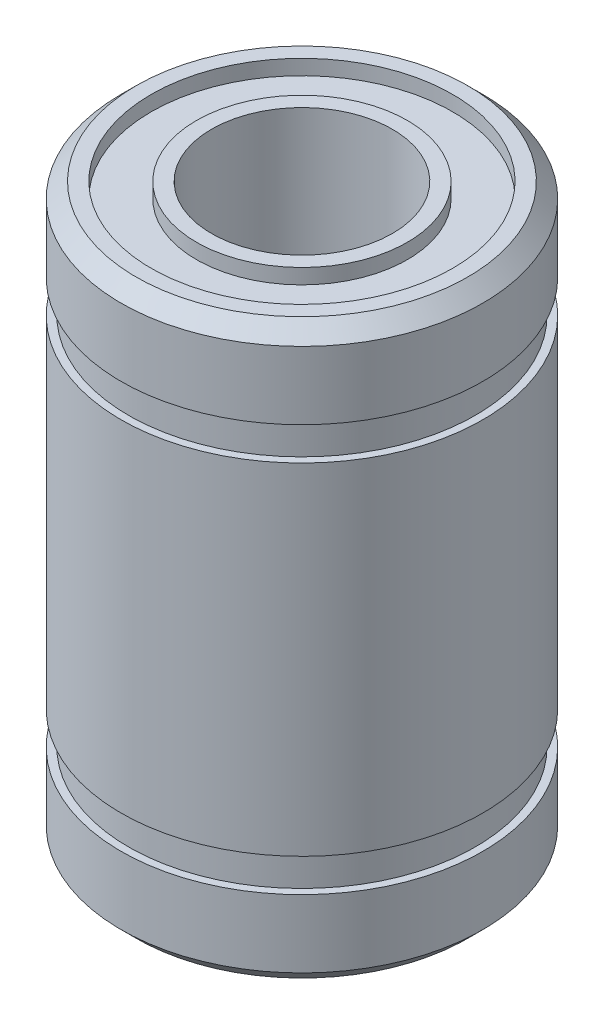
SolidWorks part; units mm, degrees
ref_plane "Front Plane" through (0, 0, 0) normal (0, 0, 1) x (1, 0, 0)
ref_plane "Top Plane" through (0, 0, 0) normal (0, 1, 0) x (1, 0, 0)
ref_plane "Right Plane" through (0, 0, 0) normal (1, 0, 0) x (0, 0, -1)
sketch "Sketch1" plane through (0, 0, 0) normal (0, 0, 1) x (1, 0, 0)
  line L0 (0, 9.5) -> (0, 0) construction
  line L1 (0, 0) -> (0, -9.5) construction
  line L2 (0, 9.5) -> (3, 9.5) construction
  line L3 (0, -9.5) -> (3, -9.5) construction
  line L4 (3, -9.5) -> (3, 9.5)
  line L5 (3, 9.5) -> (5.5, 9.5)
  line L6 (5.5, 9.5) -> (6, 9)
  line L7 (6, 9) -> (6, 6.75)
  line L8 (6, 5.65) -> (6, 6.75) construction
  line L9 (6, -6.75) -> (6, -5.65) construction
  line L10 (6, 5.65) -> (6, -5.65)
  line L11 (6, -9) -> (5.5, -9) construction
  line L12 (5.5, -9) -> (5.5, -9.5) construction
  line L13 (6, -6.75) -> (6, -9)
  line L14 (6, -9) -> (5.5, -9.5)
  line L15 (5.5, -9.5) -> (3, -9.5)
  line L16 (6, 9) -> (5.5, 9) construction
  line L17 (5.5, 9) -> (5.5, 9.5) construction
  line L18 (5.5, -9) -> (5.5, 9) construction
  line L19 (6.48, -6.2) -> (6.48, 6.2) construction
  line L20 (5.75, -6.2) -> (6.48, -6.2) construction
  line L21 (6, 6.75) -> (5.75, 6.75)
  line L22 (0, 0) -> (6, 0) construction
  line L23 (5.75, 6.75) -> (5.75, 5.65)
  line L24 (5.75, 5.65) -> (6, 5.65)
  line L25 (6, -5.65) -> (5.75, -5.65)
  line L26 (5.75, -5.65) -> (5.75, -6.75)
  line L27 (5.75, -6.75) -> (6, -6.75)
  arc A0 (6, 6.75) -> (6, 5.65) centre (6.48, 6.2) ccw construction
  arc A1 (6, -5.65) -> (6, -6.75) centre (6.48, -6.2) ccw construction
  dimension "Total_length" = 19
  dimension "Inside_diameter" = 6
  dimension "D4" = 0.5
  dimension "Distance_between_lockingrings" = 13.5
  dimension "Diameter_outside" = 12
  dimension "Locking_ring_width" = 1.1
  dimension "Locking_ring_groove_dia" = 11.5
revolve "Revolve1" add sketch "Sketch1" angle 360 about L0
sketch "Sketch2" plane through (0, 9.5, 0) normal (0, 1, 0) x (1, 0, 0)
  circle A0 centre (0, 0) radius 3.5
  circle A1 centre (0, 0) radius 5
  circle A2 centre (0, 0) radius 6 construction
  circle A3 centre (0, 0) radius 3 construction
  dimension "D1" = 1
  dimension "D2" = 0.5
extrude "Cut-Extrude1" cut sketch "Sketch2" against normal blind 0.5
mirror "Mirror1" about plane through (0, 0, 0) normal (0, 1, 0) of "Cut-Extrude1"
sketch "Sketch3"
  dimension "D1" = 0.4
